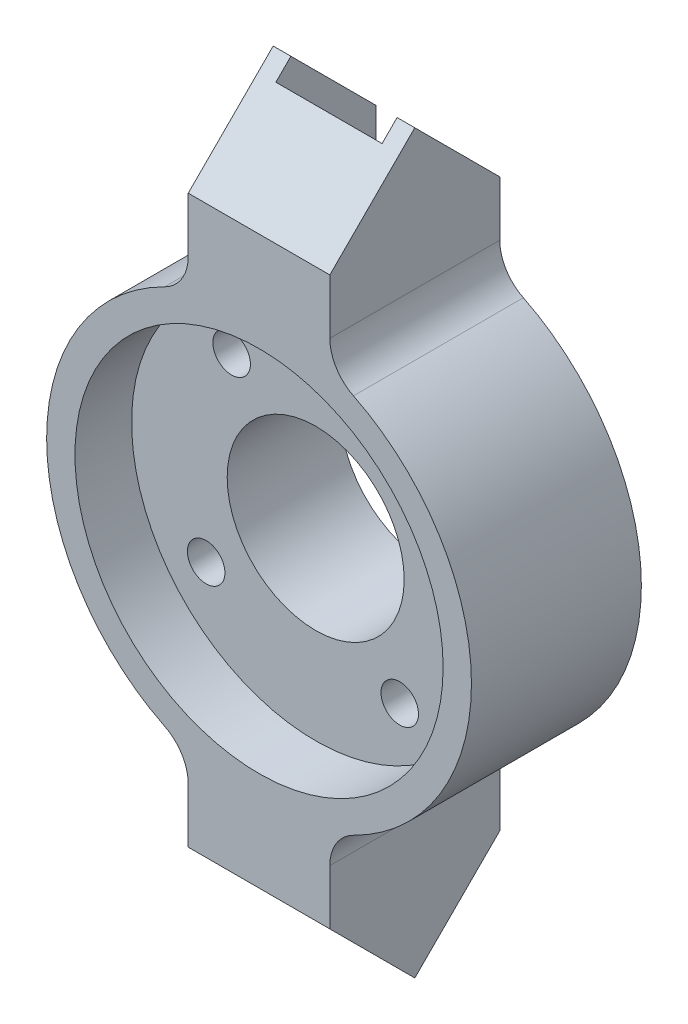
SolidWorks part; units mm, degrees
ref_plane "Plan de face" through (0, 0, 0) normal (0, 0, 1) x (1, 0, 0)
ref_plane "Plan de dessus" through (0, 0, 0) normal (0, 1, 0) x (1, 0, 0)
ref_plane "Plan de droite" through (0, 0, 0) normal (1, 0, 0) x (0, 0, -1)
sketch "Esquisse1" plane through (0, 0, 0) normal (0, 0, 1) x (1, 0, 0)
  circle A0 centre (0, 0) radius 60
extrude "Boss.-Extru.1" add sketch "Esquisse1" along normal blind 25.5
sketch "Esquisse2" plane through (0, 0, 25.5) normal (0, 0, 1) x (1, 0, 0)
  circle A0 centre (0, 0) radius 26
extrude "Enlèv. mat.-Extru.1" cut sketch "Esquisse2" against normal blind 8
sketch "Esquisse22" plane through (0, 0, 25.5) normal (0, 0, 1) x (1, 0, 0)
  line L0 (60, 0) -> (-60, 0) construction
  circle A0 centre (0, 0) radius 60 construction
  point P3 (40, 0)
  point P6 (-40, 0)
  dimension "D1" = 40
  dimension "D2" = 80
hole_wizard "Dégagement M62" positions "Esquisse26" profile "Esquisse25" hole size "M6" standard "ISO"
sketch "Esquisse26" plane through (0, 0, 25.5) normal (0, 0, 1) x (1, 0, 0)
  point P0 (-40, 0)
  point P1 (40, 0)
sketch "Esquisse25" plane through (-40, 0, 25.5) normal (1, 0, 0) x (0, -1, 0)
  line L0 (0, 0) -> (0, 28.9828)
  line L1 (0, 28.9828) -> (3.3, 27)
  line L2 (3.3, 27) -> (3.3, 0)
  line L5 (3.3, 0) -> (0, 0)
  line L10 (0, 28.9828) -> (-3.3, 27) construction
  line L11 (0, -6.35) -> (0, 107.95) construction
  dimension "Diamètre du perçage" = 6.6
  dimension "Profondeur du perçage" = 27
  dimension "Angle de pointe" = 118
sketch "Esquisse27" plane through (0, 0, 17.5) normal (0, 0, 1) x (1, 0, 0)
  line L0 (0, 0) -> (34.8109, 0) construction
  point P3 (19.5, 0)
  dimension "D1" = 19.5
hole_wizard "Diamètre du perçage Ø4.0 (4)2" positions "Esquisse31" profile "Esquisse30" hole size "Ø4.0" standard "ISO"
sketch "Esquisse31" plane through (0, 0, 17.5) normal (0, 0, 1) x (1, 0, 0)
  point P0 (19.5, 0)
sketch "Esquisse30" plane through (19.5, 0, 17.5) normal (1, 0, 0) x (0, -1, 0)
  line L0 (0, 0) -> (0, 11.2017)
  line L1 (0, 11.2017) -> (2, 10)
  line L2 (2, 10) -> (2, 0)
  line L5 (2, 0) -> (0, 0)
  line L10 (0, 11.2017) -> (-2, 10) construction
  line L11 (0, -6.35) -> (0, 107.95) construction
  dimension "Diamètre du perçage" = 4
  dimension "Profondeur du perçage" = 10
  dimension "Angle de pointe" = 118
sketch "Esquisse4" plane through (0, 0, 0) normal (0, 0, -1) x (-1, 0, 0)
  line L0 (0, 60) -> (0, -60) construction
  line L1 (60, 0) -> (-60, 0) construction
  line L2 (0, 0) -> (-15.4704, 11.8708) construction
  line L3 (0, 0) -> (11.8708, 15.4704) construction
  line L4 (0, 0) -> (-11.8708, -15.4704) construction
  line L5 (0, 0) -> (15.4704, -11.8708) construction
  circle A0 centre (0, 0) radius 19.5 construction
  circle A1 centre (0, 0) radius 60 construction
  point P10 (-19.5, 0)
  dimension "D1" = 52.5
  dimension "D2" = 90
  dimension "D3" = 90
  dimension "D4" = 90
sketch "Esquisse9" plane through (0, 0, 0) normal (0, 0, -1) x (-1, 0, 0)
  circle A0 centre (0, 0) radius 12.5
extrude "Enlèv. mat.-Extru.4" cut sketch "Esquisse9" against normal through all
hole_wizard "Diamètre du perçage Ø5.3 (5.3)1" positions "Esquisse6" profile "Esquisse5" hole size "Ø5.3" standard "ISO"
sketch "Esquisse6" plane through (0, 0, 0) normal (0, 0, -1) x (-1, 0, 0)
  point P0 (-15.4704, 11.8708)
  point P1 (-11.8708, -15.4704)
  point P4 (15.4704, -11.8708)
  point P7 (11.8708, 15.4704)
sketch "Esquisse5" plane through (15.4704, 11.8708, 0) normal (1, 0, 0) x (0, 1, 0)
  line L0 (0, 0) -> (0, 25.5)
  line L1 (0, 25.5) -> (2.65, 25.5)
  line L2 (2.65, 25.5) -> (2.65, 0)
  line L5 (2.65, 0) -> (0, 0)
  line L11 (0, -6.35) -> (0, 107.95) construction
  dimension "Diamètre du perçage jusqu'au prochain" = 5.3
  dimension "Profondeur du perçage jusqu'au prochain" = 25.5
sketch "Esquisse7" plane through (0, 0, 0) normal (0, 0, -1) x (-1, 0, 0)
  circle A0 centre (-15.4704, 11.8708) radius 5
  circle A1 centre (11.8708, 15.4704) radius 5
  circle A2 centre (-11.8708, -15.4704) radius 5
  circle A3 centre (15.4704, -11.8708) radius 5
extrude "Enlèv. mat.-Extru.3" cut sketch "Esquisse7" against normal blind 5
sketch "Esquisse11" plane through (0, 0, 0) normal (0, 0, -1) x (-1, 0, 0)
  circle A0 centre (0, 0) radius 60
extrude "Enlèv. mat.-Extru.6" cut sketch "Esquisse11" against normal blind 1.5
sketch "Esquisse12" plane through (0, 0, 1.5) normal (0, 0, -1) x (-1, 0, 0)
  line L0 (-10, 28.2843) -> (-10, 55)
  line L1 (-10, 55) -> (10, 55)
  line L2 (10, 55) -> (10, 28.2843)
  line L3 (-10, -28.2843) -> (-10, -55)
  line L4 (-10, -55) -> (10, -55)
  line L5 (10, -55) -> (10, -28.2843)
  line L6 (60, 0) -> (-60, 0) construction
  line L7 (0, 60) -> (0, -60) construction
  arc A0 (-10, 28.2843) -> (-10, -28.2843) centre (0, 0) ccw
  arc A1 (10, -28.2843) -> (10, 28.2843) centre (0, 0) ccw
  dimension "D1" = 110
  dimension "D2" = 55
  dimension "D3" = 10
  dimension "D4" = 20
  dimension "D5" = 20
extrude "Enlèv. mat.-Extru.7" cut sketch "Esquisse12" against normal through all flip side to cut
fillet "Congé2" radius 6 4 edges at (10, -28.2843, 13.5) (-10, -28.2843, 13.5) (-10, 28.2843, 13.5) (10, 28.2843, 13.5)
chamfer "Chanfrein2" distance 15 angle 45 1 edges at (0, 55, 1.5)
chamfer "Chanfrein3" distance 15 angle 45 1 edges at (0, -55, 1.5)
sketch "Esquisse14" plane through (0, 19.25, -19.25) normal (0, 0.7071, -0.7071) x (1, 0, 0)
  line L0 (-10, -50.5581) -> (-10, -29.3449) construction
  line L1 (7.5, -57.3449) -> (-7.5, -57.3449)
  line L2 (7.5, -57.3449) -> (7.5, -22.3449)
  line L3 (7.5, -22.3449) -> (-7.5, -22.3449)
  line L4 (-7.5, -57.3449) -> (-7.5, -22.3449)
  line L5 (-10, -29.3449) -> (10, -29.3449) construction
  dimension "D1" = 15
  dimension "D2" = 2.5
  dimension "D3" = 35
  dimension "D4" = 7
extrude "Enlèv. mat.-Extru.9" cut sketch "Esquisse14" against normal blind 3
sketch "Esquisse15" plane through (0, -19.25, -19.25) normal (0, -0.7071, -0.7071) x (1, 0, 0)
  line L0 (10, 29.3449) -> (-10, 29.3449) construction
  line L1 (-7.5, 57.3449) -> (7.5, 57.3449)
  line L2 (-7.5, 57.3449) -> (-7.5, 22.3449)
  line L3 (-7.5, 22.3449) -> (7.5, 22.3449)
  line L4 (7.5, 57.3449) -> (7.5, 22.3449)
  line L5 (10, 50.5581) -> (10, 29.3449) construction
  dimension "D1" = 15
  dimension "D2" = 35
  dimension "D3" = 7
  dimension "D4" = 2.5
extrude "Enlèv. mat.-Extru.10" cut sketch "Esquisse15" against normal blind 3
chamfer "Chanfrein4" distance 15 angle 45 1 edges at (0, 55, 25.5)
chamfer "Chanfrein5" distance 15 angle 45 1 edges at (0, -55, 25.5)
hole_wizard "Trou taraudé M101" positions "Esquisse17" profile "Esquisse16" tap size "M10" standard "ISO"
sketch "Esquisse17" plane through (0, -17.1287, -17.1287) normal (0, -0.7071, -0.7071) x (1, 0, 0)
  line L0 (-7.5, 46.3155) -> (-7.5, 26.3449) construction
  line L1 (7.5, 46.3155) -> (-7.5, 46.3155) construction
  point P0 (0, 35.8155)
  dimension "D1" = 7.5
  dimension "D2" = 10.5
sketch "Esquisse16" plane through (0, -42.4541, 8.1967) normal (1, 0, 0) x (0, 0.7071, -0.7071)
  line L0 (0, 0) -> (0, 21.0537)
  line L1 (0, 21.0537) -> (4.25, 18.5)
  line L2 (4.25, 18.5) -> (4.25, 0)
  line L5 (4.25, 0) -> (0, 0)
  line L10 (0, 21.0537) -> (-4.25, 18.5) construction
  line L11 (0, -6.35) -> (0, 107.95) construction
  dimension "Diamètre du trou pour taraudage" = 8.5
  dimension "Profondeur du trou pour taraudage" = 18.5
  dimension "Angle de pointe" = 118
hole_wizard "Trou taraudé M102" positions "Esquisse19" profile "Esquisse18" tap size "M10" standard "ISO"
sketch "Esquisse19" plane through (0, 17.1287, -17.1287) normal (0, 0.7071, -0.7071) x (-1, 0, 0)
  line L0 (7.5, 46.3155) -> (-7.5, 46.3155) construction
  line L1 (7.5, 26.3449) -> (7.5, 46.3155) construction
  point P0 (0, 35.8155)
  dimension "D1" = 10.5
  dimension "D2" = 7.5
sketch "Esquisse18" plane through (0, 42.4541, 8.1967) normal (1, 0, 0) x (0, 0.7071, 0.7071)
  line L0 (0, 0) -> (0, 21.0537)
  line L1 (0, 21.0537) -> (4.25, 18.5)
  line L2 (4.25, 18.5) -> (4.25, 0)
  line L5 (4.25, 0) -> (0, 0)
  line L10 (0, 21.0537) -> (-4.25, 18.5) construction
  line L11 (0, -6.35) -> (0, 107.95) construction
  dimension "Diamètre du trou pour taraudage" = 8.5
  dimension "Profondeur du trou pour taraudage" = 18.5
  dimension "Angle de pointe" = 118
chamfer "Chanfrein6" distance 0.5 angle 45 1 edges at (21.5, 0, 17.5)
sketch "Esquisse33" plane through (0, 0, 1.5) normal (0, 0, -1) x (-1, 0, 0)
  line L0 (10, -32.249) -> (10, -52)
  line L1 (10, -52) -> (-10, -52)
  line L2 (-10, -52) -> (-10, -32.249)
  line L3 (-10, 32.249) -> (-10, 52)
  line L4 (-10, 52) -> (10, 52)
  line L5 (10, 52) -> (10, 32.249)
  line L6 (10, 32.249) -> (10, 40) construction
  circle A0 centre (0, 0) radius 75
  arc A1 (-10, -32.249) -> (-13.3333, -26.8742) centre (-16, -32.249) ccw
  arc A2 (-13.3333, -26.8742) -> (-13.3333, 26.8742) centre (0, 0) cw
  arc A3 (-13.3333, 26.8742) -> (-10, 32.249) centre (-16, 32.249) ccw
  arc A4 (10, 32.249) -> (13.3333, 26.8742) centre (16, 32.249) ccw construction
  arc A5 (10, 32.249) -> (13.3333, 26.8742) centre (16, 32.249) ccw
  arc A6 (13.3333, 26.8742) -> (13.3333, -26.8742) centre (0, 0) cw
  arc A7 (13.3333, -26.8742) -> (13.3333, 26.8742) centre (0, 0) ccw construction
  arc A8 (13.3333, -26.8742) -> (10, -32.249) centre (16, -32.249) ccw
sketch "Esquisse34" plane through (0, 0, 1.5) normal (0, 0, -1) x (-1, 0, 0)
  line L0 (10, -32.249) -> (10, -52)
  line L1 (10, -40) -> (10, -32.249) construction
  line L2 (10, -52) -> (-10, -52)
  line L3 (-10, -52) -> (-10, -32.249)
  line L4 (-10, 32.249) -> (-10, 52)
  line L5 (-10, 52) -> (10, 52)
  line L6 (10, 52) -> (10, 32.249)
  arc A0 (13.3333, -26.8742) -> (10, -32.249) centre (16, -32.249) ccw construction
  arc A1 (-10, -32.249) -> (-13.3333, -26.8742) centre (-16, -32.249) ccw
  arc A2 (-13.3333, -26.8742) -> (-13.3333, 26.8742) centre (0, 0) cw
  arc A3 (-13.3333, 26.8742) -> (-10, 32.249) centre (-16, 32.249) ccw
  arc A4 (10, 32.249) -> (13.3333, 26.8742) centre (16, 32.249) ccw
  arc A5 (13.3333, 26.8742) -> (13.3333, -26.8742) centre (0, 0) cw
  arc A6 (13.3333, -26.8742) -> (10, -32.249) centre (16, -32.249) ccw
sketch "Esquisse35" plane through (0, 19.25, -19.25) normal (0, 0.7071, -0.7071) x (1, 0, 0)
  line L0 (-10, -46.3155) -> (-10, -29.3449) construction
  line L1 (10, -29.3449) -> (-10, -29.3449)
  line L2 (10, -29.3449) -> (10, -46.3155)
  line L3 (10, -46.3155) -> (-10, -46.3155)
  line L4 (-10, -29.3449) -> (-10, -46.3155)
  line L5 (-10, -46.3155) -> (-7.5, -46.3155) construction
sketch "Esquisse40" plane through (0, -19.25, -19.25) normal (0, -0.7071, -0.7071) x (1, 0, 0)
  line L0 (10, 46.3155) -> (10, 29.3449)
  line L1 (10, 29.3449) -> (-10, 29.3449)
  line L2 (-10, 29.3449) -> (-10, 46.3155)
  line L3 (-10, 46.3155) -> (10, 46.3155)
